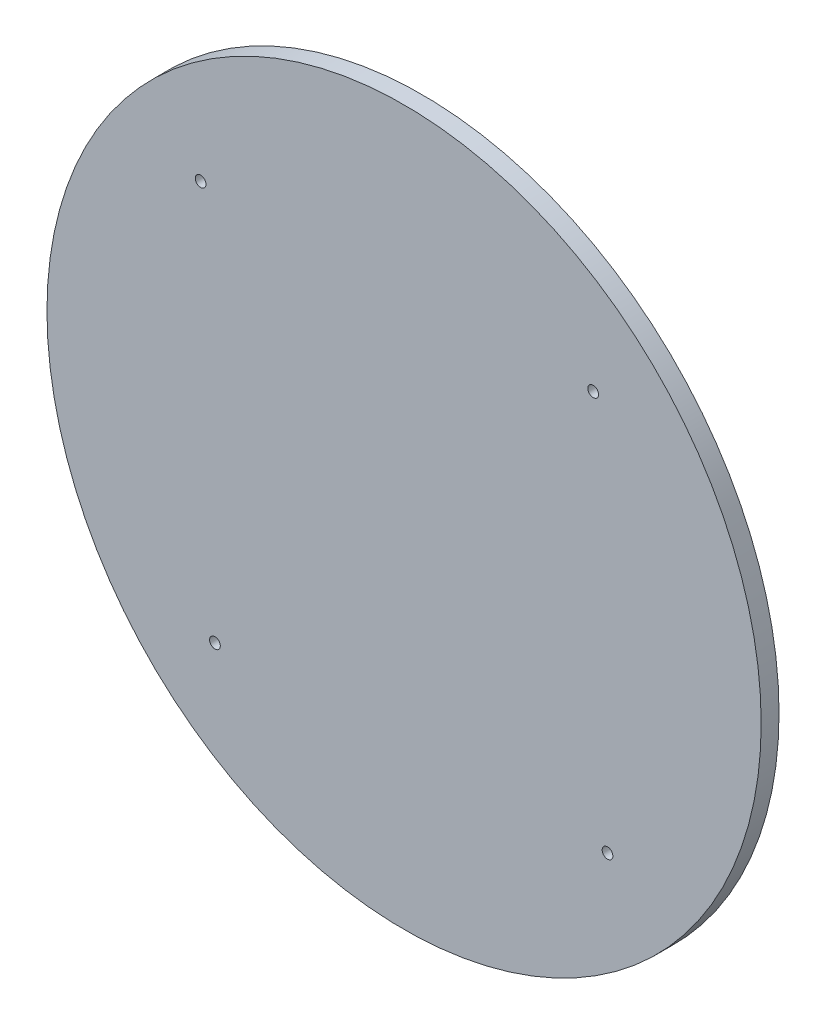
SolidWorks part; units mm, degrees
ref_plane "Front Plane" through (0, 0, 0) normal (0, 0, 1) x (1, 0, 0)
ref_plane "Top Plane" through (0, 0, 0) normal (0, 1, 0) x (1, 0, 0)
ref_plane "Right Plane" through (0, 0, 0) normal (1, 0, 0) x (0, 0, -1)
sketch "Sketch2" plane through (0, 0, 0) normal (0, 0, 1) x (1, 0, 0)
  circle A0 centre (0, 0) radius 100
  circle A1 centre (0, 0) radius 100 construction
extrude "Boss-Extrude1" add sketch "Sketch2" along normal blind 5
sketch "Sketch3" plane through (0, 0, 0) normal (0, 0, -1) x (-1, 0, 0)
  line L0 (-56.9668, -52.9602) -> (-52.9602, 56.9668) construction
  line L1 (-56.9668, -52.9602) -> (-52.9602, 56.9668)
  line L2 (-56.9668, -52.9602) -> (52.9602, -56.9668) construction
  line L3 (52.9602, -56.9668) -> (56.9668, 52.9602) construction
  line L4 (-52.9602, 56.9668) -> (56.9668, 52.9602) construction
  line L5 (-56.9668, -52.9602) -> (52.9602, -56.9668)
  line L6 (52.9602, -56.9668) -> (56.9668, 52.9602)
  line L7 (-52.9602, 56.9668) -> (56.9668, 52.9602)
hole_wizard "Ø3.0 (3) Diameter Hole1" positions "Sketch4" profile "Sketch5" hole size "Ø3.0" standard "DIN"
sketch "Sketch4" plane through (0, 0, 0) normal (0, 0, -1) x (-1, 0, 0)
  point P0 (56.9668, 52.9602)
sketch "Sketch5" plane through (-56.9668, 52.9602, 0) normal (1, 0, 0) x (0, 1, 0)
  line L0 (0, 0) -> (0, 5)
  line L1 (0, 5) -> (1.5, 5)
  line L2 (1.5, 5) -> (1.5, 0)
  line L5 (1.5, 0) -> (0, 0)
  line L11 (0, -6.35) -> (0, 107.95) construction
  dimension "Thru Hole Dia." = 3
  dimension "Thru Hole Depth" = 5
pattern_curve "CrvPattern2" of "Ø3.0 (3) Diameter Hole1" parameters "D1"=2, "D3"=10, "D2"=2, "D4"=10
